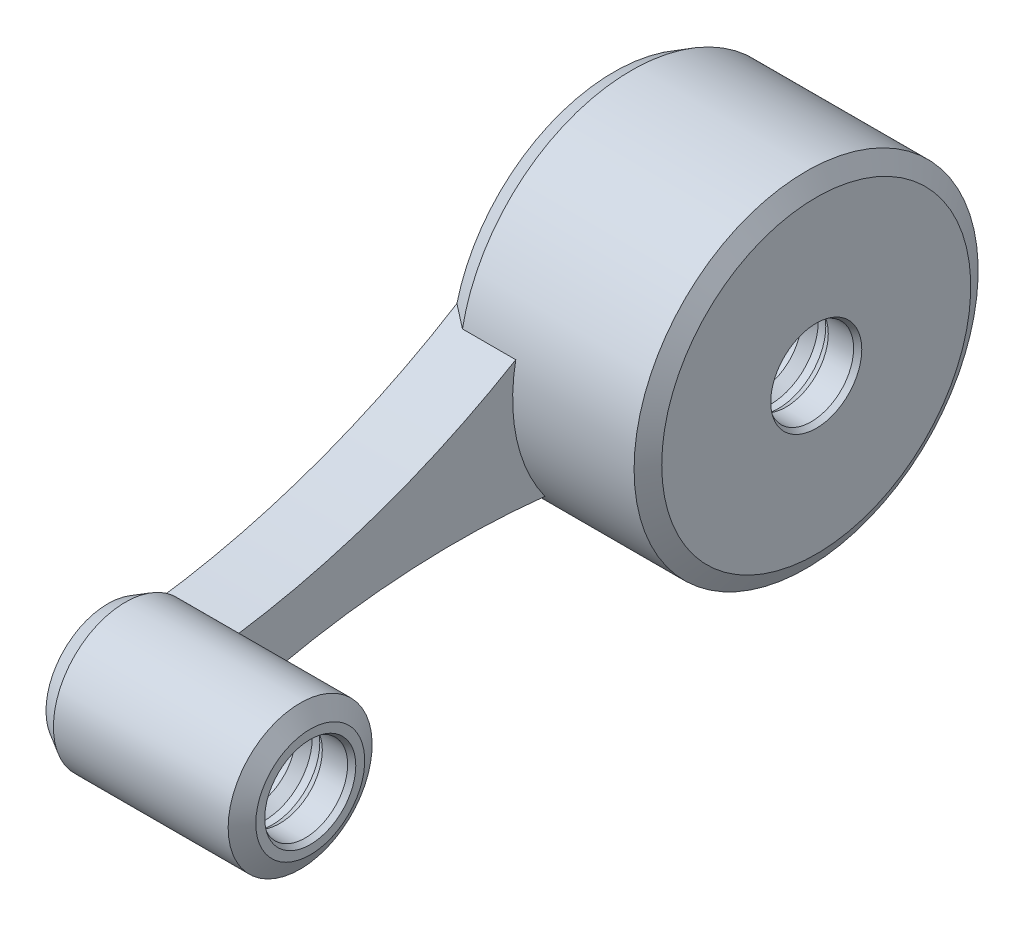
SolidWorks part; units mm, degrees
ref_plane "Front Plane" through (0, 0, 0) normal (0, 0, 1) x (1, 0, 0)
ref_plane "Top Plane" through (0, 0, 0) normal (0, 1, 0) x (1, 0, 0)
ref_plane "Right Plane" through (0, 0, 0) normal (1, 0, 0) x (0, 0, -1)
mirrored part "tread4_Mirrored"
other "<tread4>-<Mirror1>"
